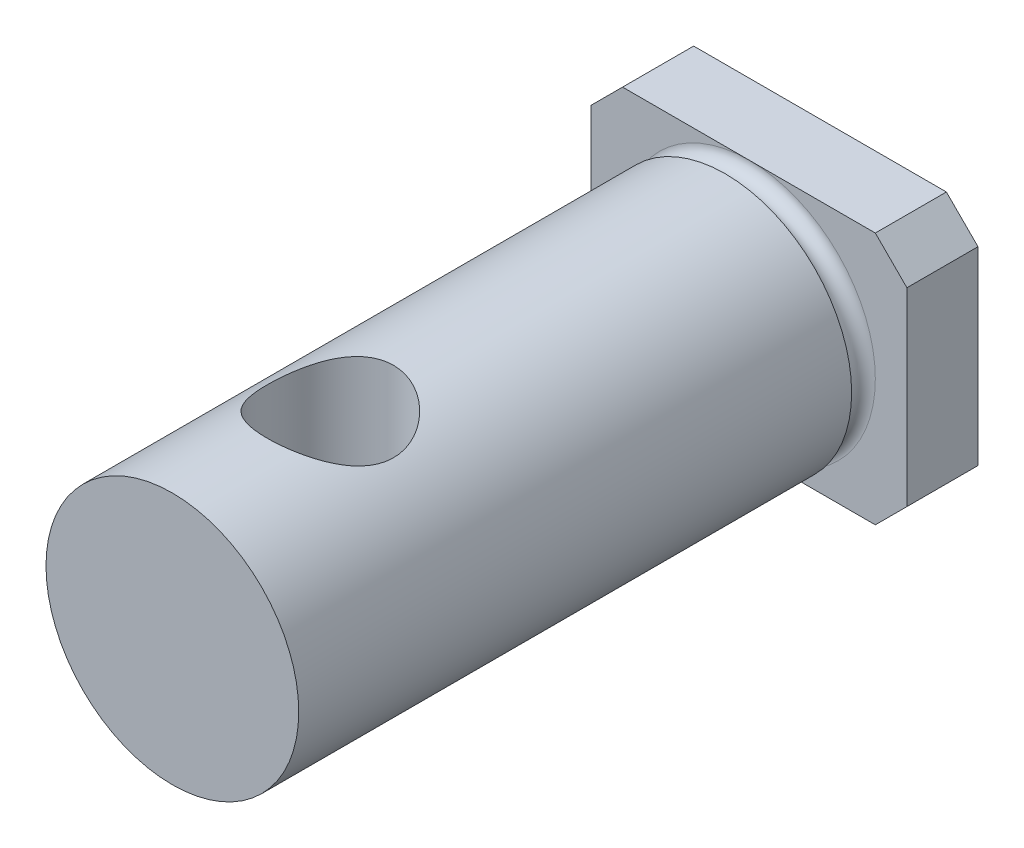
SolidWorks part; units mm, degrees
ref_plane "Front Plane" through (0, 0, 0) normal (0, 0, 1) x (1, 0, 0)
ref_plane "Top Plane" through (0, 0, 0) normal (0, 1, 0) x (1, 0, 0)
ref_plane "Right Plane" through (0, 0, 0) normal (1, 0, 0) x (0, 0, -1)
sketch "Sketch1" plane through (0, 0, 0) normal (0, 0, 1) x (1, 0, 0)
  line L0 (0, 4) -> (0, 0) construction
  line L1 (-5, 4) -> (5, 4)
  line L2 (-5, 4) -> (-5, -4)
  line L3 (-5, -4) -> (5, -4)
  line L4 (5, 4) -> (5, -4)
  line L5 (0, 0) -> (5, 0) construction
  dimension "D1" = 8
  dimension "D2" = 10
extrude "Boss-Extrude1" add sketch "Sketch1" along normal blind 2.25
chamfer "Chamfer1" distance 1 angle 45 4 edges at (-5, 4, 1.125) (-5, -4, 1.125) (5, -4, 1.125) (5, 4, 1.125)
sketch "Sketch2" plane through (0, 0, 2.25) normal (0, 0, 1) x (1, 0, 0)
  circle A0 centre (0, 0) radius 4
  dimension "D1" = 8
extrude "Boss-Extrude2" add sketch "Sketch2" along normal blind 20.5 from surface at -2.25
sketch "Sketch3" plane through (0, 0, 0) normal (0, 1, 0) x (1, 0, 0)
  line L0 (3.625, -2.625) -> (-3.625, -2.625) construction
  line L1 (0, -2.625) -> (0, 0) construction
  line L2 (-3.625, -2.625) -> (-4, -2.625) construction
  line L3 (-4, -2.25) -> (-4, -20.5) construction
  line L4 (-4, -2.25) -> (-5, -2.25) construction
  line L5 (0, -2.625) -> (0, -3) construction
  line L6 (-4, -3) -> (0, -3) construction
  circle A0 centre (-4, -2.625) radius 0.375
  dimension "D1" = 7.25
revolve "Cut-Revolve1" cut sketch "Sketch3" angle 360 about L1
sketch "Sketch4" plane through (0, 0, 0) normal (0, 1, 0) x (1, 0, 0)
  line L0 (0, -20.5) -> (0, -17.5) construction
  line L1 (-4, -20.5) -> (4, -20.5) construction
  circle A0 centre (0, -15.5) radius 2
  dimension "D1" = 4
  dimension "D2" = 3
extrude "Cut-Extrude1" cut sketch "Sketch4" against normal up to next and the other way up to next
